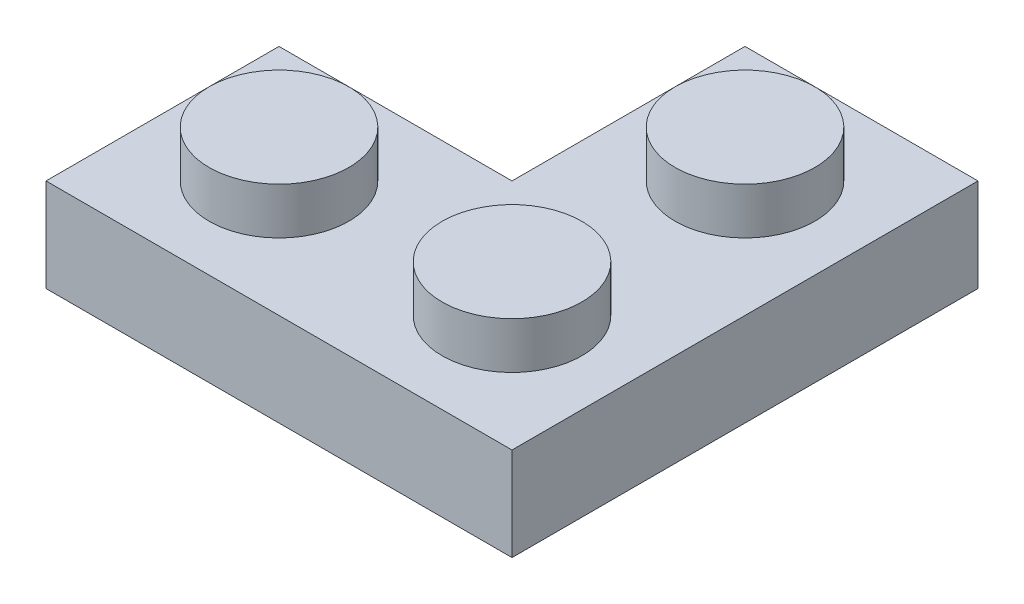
SolidWorks part; units mm, degrees
ref_plane "Front Plane" through (0, 0, 0) normal (0, 0, 1) x (1, 0, 0)
ref_plane "Top Plane" through (0, 0, 0) normal (0, 1, 0) x (1, 0, 0)
ref_plane "Right Plane" through (0, 0, 0) normal (1, 0, 0) x (0, 0, -1)
sketch "Sketch1" plane through (0, 0, 0) normal (0, 0, 1) x (1, 0, 0)
  line L0 (0, 0) -> (16, 0)
  line L1 (16, 0) -> (16, 3.2)
  line L2 (16, 3.2) -> (0, 3.2)
  line L3 (0, 3.2) -> (0, 0)
  dimension "D1" = 16
  dimension "D2" = 3.2
extrude "Boss-Extrude1" add sketch "Sketch1" against normal blind 8
sketch "Sketch2" plane through (16, 0, 0) normal (1, 0, 0) x (0, 0, -1)
  line L0 (8, 0) -> (16, 0)
  line L1 (16, 0) -> (16, 3.2)
  line L2 (8, 3.2) -> (16, 3.2)
  line L3 (8, 3.2) -> (8, 0)
  dimension "D1" = 8
  dimension "D2" = 3.2
extrude "Boss-Extrude2" add sketch "Sketch2" against normal blind 8
sketch "Sketch3" plane through (0, 3.2, 0) normal (0, 1, 0) x (1, 0, 0)
  line L0 (8, 16) -> (8, 12) construction
  line L1 (8, 16) -> (8, 8) construction
  line L2 (8, 12) -> (12, 12) construction
  line L3 (12, 12) -> (12, 4) construction
  line L4 (0, 0) -> (4, 0) construction
  line L5 (-1.76, 0) -> (1.76, 0) construction
  line L6 (4, 0) -> (4, 4) construction
  circle A0 centre (12, 12) radius 2.4
  circle A1 centre (12, 4) radius 2.4
  circle A2 centre (4, 4) radius 2.4
  dimension "D2" = 8
  dimension "D3" = 4
  dimension "D1" = 4
  dimension "D4" = 4
extrude "Boss-Extrude3" add sketch "Sketch3" along normal blind 1.6
shell "Shell1" thickness 1.6
sketch "Sketch4" plane through (0, 1.6, 0) normal (0, -1, 0) x (1, 0, 0)
  line L0 (0, -4) -> (8, -4) construction
  line L1 (0, -8) -> (0, 0) construction
  line L2 (12, -16) -> (12, -8) construction
  line L3 (8, -16) -> (16, -16) construction
  circle A0 centre (8, -4) radius 1.77
  circle A1 centre (12, -8) radius 1.77
  dimension "D2" = 8
  dimension "D1" = 8
extrude "Boss-Extrude4" add sketch "Sketch4" along normal blind 1.6
